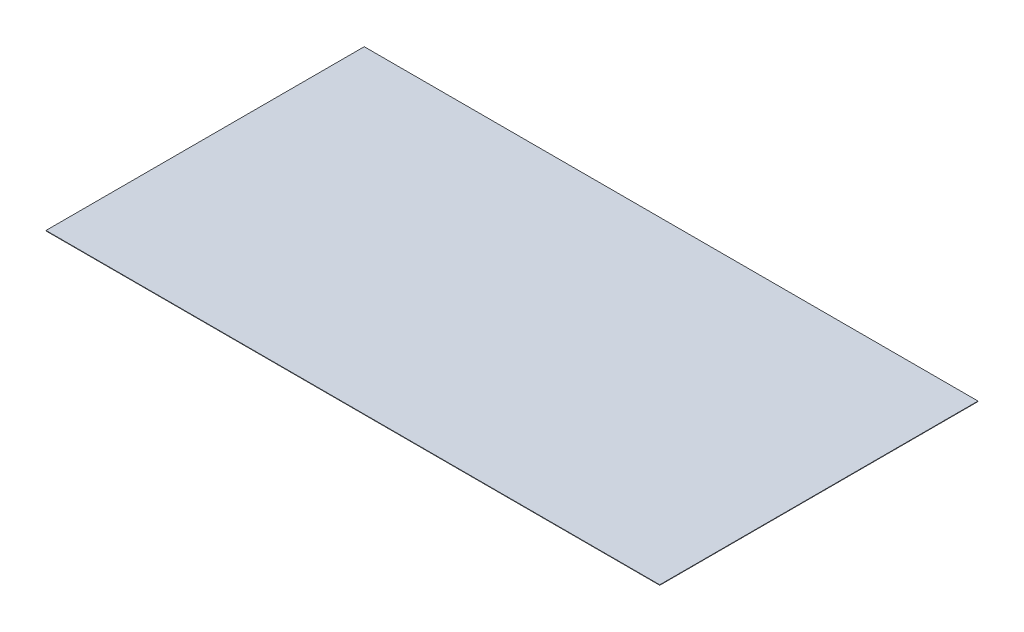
SolidWorks part; units mm, degrees
ref_plane "Front Plane" through (0, 0, 0) normal (0, 0, 1) x (1, 0, 0)
ref_plane "Top Plane" through (0, 0, 0) normal (0, 1, 0) x (1, 0, 0)
ref_plane "Right Plane" through (0, 0, 0) normal (1, 0, 0) x (0, 0, -1)
sketch "Sketch1" plane through (0, 0, 0) normal (0, 1, 0) x (1, 0, 0)
  line L1 (-685.8, -355.6) -> (685.8, -355.6)
  line L2 (-685.8, -355.6) -> (-685.8, 355.6)
  line L3 (-685.8, 355.6) -> (685.8, 355.6)
  line L4 (685.8, -355.6) -> (685.8, 355.6)
  line L5 (-685.8, -355.6) -> (685.8, 355.6) construction
  line L6 (-685.8, 355.6) -> (685.8, -355.6) construction
  point P0 (0, 0)
  dimension "D1" = 711.2
  dimension "D2" = 1371.6
base flange "Base-Flange1" sketch "Sketch1" thickness 1 reverse thickness direction no parameters "D1"=2
sketch "Bend-Lines1" [suppressed] plane through (0, 0, 0) normal (0, 1, 0) x (1, 0, 0)
sketch "Bounding-Box1" [suppressed] plane through (0, 0, 0) normal (0, 1, 0) x (1, 0, 0)
sheet metal parameters "Sheet-Metal1" thickness 1 parameters "D1"=2
flat pattern "Flat-Pattern1"
sketch "Bend-Lines2" plane through (0, 0, 0) normal (0, 1, 0) x (1, 0, 0)
sketch3d "Bounding-Box2" [suppressed]
  line L0 (685.8, 355.6, 0) -> (-685.8, 355.6, 0) construction
  line L1 (685.8, -355.6, 0) -> (-685.8, -355.6, 0) construction
  line L2 (685.8, 355.6, 0) -> (685.8, -355.6, 0) construction
  line L3 (-685.8, 355.6, 0) -> (-685.8, -355.6, 0) construction
